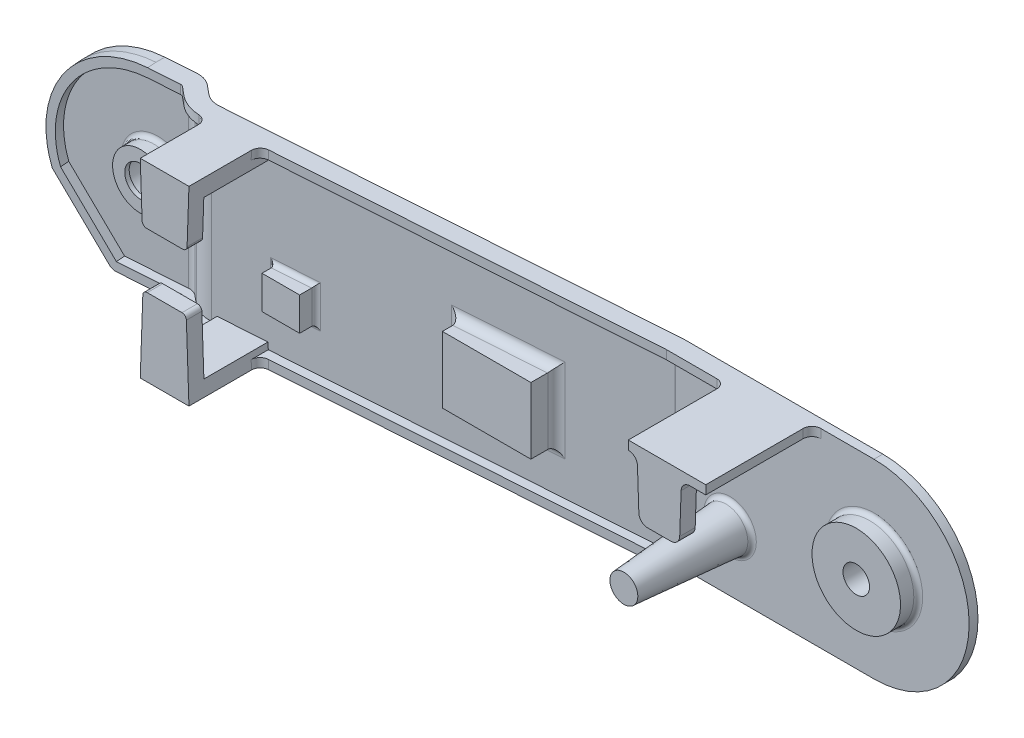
SolidWorks part; units mm, degrees
ref_plane "Plan de face" through (0, 0, 0) normal (0, 0, 1) x (1, 0, 0)
ref_plane "Plan de dessus" through (0, 0, 0) normal (0, 1, 0) x (1, 0, 0)
ref_plane "Plan de droite" through (0, 0, 0) normal (1, 0, 0) x (0, 0, -1)
inserted part "avt bras droit01<1>Assemblage1"
sketch "Esquisse2" plane through (0, 0, 0) normal (0, 0, 1) x (1, 0, 0)
  line L0 (-283.5, 43) -> (-282.6595, 18.9302)
  line L1 (-89.7206, 43) -> (-285.4403, 43) construction
  line L2 (-280.6607, 17) -> (-264.3393, 17)
  line L3 (-262.3405, 18.9302) -> (-261.5, 43)
  line L4 (-261.5, 43) -> (-283.5, 43)
  line L5 (-272.5, 72.3217) -> (-272.5, -3.6699) construction
  line L6 (-261.5, 92.2605) -> (-261.5, -33.5548) construction
  line L7 (-282.5921, 90.6779) -> (-282.5921, -30.1645) construction
  arc A0 (-280.6607, 17) -> (-282.6595, 18.9302) centre (-280.6607, 19) cw
  arc A1 (-262.3405, 18.9302) -> (-264.3393, 17) centre (-264.3393, 19) cw
  point P15 (-282.5921, 17)
  dimension "D6" = 2
  dimension "D7" = 2
  dimension "D1" = 22
  dimension "D2" = 11
  dimension "D3" = 272.5
  dimension "D4" = 2
  dimension "D5" = 2
  dimension "D8" = 26
extrude "Extrusion1" add sketch "Esquisse2" along normal blind 56
sketch "Esquisse3" plane through (0, 43, 0) normal (0, 1, 0) x (-1, 0, 0)
  line L0 (261.5, 11.9924) -> (283.5, 13.5308)
  line L1 (283.5, 13.5308) -> (283.5, 0)
  line L2 (283.5, 0) -> (261.5, 0)
  line L3 (261.5, 0) -> (261.5, 11.9924)
extrude "Enlèv. mat.-Extru.1" cut sketch "Esquisse3" against normal through all
sketch "Esquisse6" plane through (0, 17, 0) normal (0, -1, 0) x (1, 0, 0)
  line L0 (-264.7148, 16.227) -> (-258.0219, 15.759) construction
  line L1 (-280.6607, 17.3421) -> (-264.3393, 16.2008) construction
  line L2 (-258.0219, 15.759) -> (-285.1238, 17.6541) construction
  line L3 (-283.5387, 17.5433) -> (-260.9848, 15.9662)
  line L4 (-260.9848, 15.9662) -> (-260.9848, 45)
  line L5 (-260.9848, 45) -> (-283.5387, 45)
  line L6 (-283.5387, 45) -> (-283.5387, 17.5433)
  line L7 (-280.6607, 56) -> (-264.3393, 56) construction
  dimension "D1" = 11
extrude "Enlèv. mat.-Extru.3" cut sketch "Esquisse6" against normal blind 18
sketch "Esquisse8" plane through (0, 0, 56) normal (0, 0, 1) x (1, 0, 0)
  line L0 (-283.5, -43) -> (-261.5, -43)
  line L1 (-285.4403, -43) -> (-87.4759, -43) construction
  line L2 (-261.5, -43) -> (-262.6548, -9.9302)
  line L3 (-264.6536, -8) -> (-280.3464, -8)
  line L4 (-282.3452, -9.9302) -> (-283.5, -43)
  line L5 (-272.5, 56.3461) -> (-272.5, -71.7255) construction
  line L6 (-283.5, -2.5567) -> (-283.5, -61.1241) construction
  line L7 (-261.5, 6.465) -> (-261.5, -60.2367) construction
  arc A0 (-282.3452, -9.9302) -> (-280.3464, -8) centre (-280.3464, -10) cw
  arc A1 (-262.6548, -9.9302) -> (-264.6536, -8) centre (-264.6536, -10) ccw
  dimension "D4" = 2
  dimension "D1" = 22
  dimension "D2" = 11
  dimension "D3" = 272.5
  dimension "D5" = 2
  dimension "D6" = 2
  dimension "D7" = 35
extrude "Extrusion2" add sketch "Esquisse8" against normal up to next
sketch "Esquisse9" plane through (0, -8, 0) normal (0, 1, 0) x (-1, 0, 0)
  line L0 (279.6459, 17.2711) -> (289.4305, 17.9553) construction
  line L2 (264.6536, 16.2227) -> (280.3464, 17.3201) construction
  line L3 (289.4305, 17.9553) -> (260.9602, 15.9645) construction
  line L4 (260.9602, 15.9645) -> (284.5382, 17.6132)
  line L5 (284.5382, 17.6132) -> (284.5382, 45)
  line L6 (284.5382, 45) -> (260.9602, 45)
  line L7 (260.9602, 45) -> (260.9602, 15.9645)
  line L8 (264.6536, 56) -> (280.3464, 56) construction
  dimension "D1" = 11
extrude "Enlèv. mat.-Extru.4" cut sketch "Esquisse9" against normal blind 28
sketch "Esquisse10" plane through (0, 0, 4) normal (0, 0, 1) x (1, 0, 0)
  line L0 (-250, 20.9787) -> (-250, -99.7083) construction
  line L1 (-258.5, -4.5) -> (-241.5, -4.5)
  line L2 (-258.5, -4.5) -> (-258.5, -19.5)
  line L3 (-258.5, -19.5) -> (-241.5, -19.5)
  line L4 (-241.5, -4.5) -> (-241.5, -19.5)
  line L5 (-276.2948, -12) -> (-204.1654, -12) construction
  dimension "D1" = 17
  dimension "D2" = 15
  dimension "D3" = 8.5
  dimension "D4" = 7.5
  dimension "D5" = 12
  dimension "D6" = 250
extrude "Extrusion3" add sketch "Esquisse10" along normal blind 18
sketch "Esquisse11" plane through (0, -4.5, 0) normal (0, 1, 0) x (-1, 0, 0)
  line L0 (241.5, 10.5939) -> (241.5, 4)
  line L1 (241.5, 4) -> (258.5, 4)
  line L2 (258.5, 4) -> (258.5, 11.7827)
  line L3 (258.5, 11.7827) -> (241.5, 10.5939)
extrude "Enlèv. mat.-Extru.5" cut sketch "Esquisse11" against normal through all
fillet "Congé1" radius 2 4 edges at (-258.5, -12, 15.7924) (-250, -19.5, 15.1981) (-250, -4.5, 15.1981) (-241.5, -12, 14.6037)
fillet "Congé2" radius 4 5 edges at (-285.4403, 41, 21.6861) (-63, 41, 8) (-28, 41, 4) (-283.4302, 41, 21.5455) (-261.5698, 41, 20.0169)
fillet "Congé3" radius 4 3 edges at (-285.4403, -41, 21.6861) (-261.5698, -41, 20.0169) (-283.4302, -41, 21.5455)
ref_plane "Plan1" through (0, 0, 6) normal (0, 0, -1) x (-1, 0, 0)
sketch "Esquisse12" plane through (0, 0, 6) normal (0, 0, -1) x (-1, 0, 0)
  line L0 (393.3523, 0) -> (-164.8619, 0) construction
  line L2 (300, 10) -> (150, 10)
  line L3 (300, 10) -> (300, -10)
  line L4 (300, -10) -> (150, -10)
  line L5 (150, 10) -> (150, -10)
  dimension "D1" = 150
  dimension "D2" = 10
  dimension "D3" = 20
  dimension "D4" = 300
extrude "Extrusion4" add sketch "Esquisse12" against normal up to body separate body
sketch "Esquisse13" plane through (0, 0, 12) normal (0, 0, 1) x (1, 0, 0)
  circle A0 centre (0, 0) radius 6
extrude "Enlèv. mat.-Extru.6" cut sketch "Esquisse13" against normal through all
sketch "Esquisse14" plane through (0, 0, 0) normal (0, 0, -1) x (-1, 0, 0)
  circle A0 centre (0, 0) radius 7.5
extrude "Enlèv. mat.-Extru.7" cut sketch "Esquisse14" against normal blind 1
sketch "Esquisse16" plane through (0, 0, 0) normal (0, 0, -1) x (-1, 0, 0)
  circle A0 centre (317.5, 0) radius 12.5
  dimension "D1" = 25
extrude "Extrusion5" add sketch "Esquisse16" against normal blind 18
sketch "Esquisse17" plane through (0, 43, 0) normal (0, 1, 0) x (-1, 0, 0)
  line L0 (295, 5) -> (340, 5) construction
  line L1 (303.1093, 5) -> (333.3189, 5)
  line L2 (303.1093, 5) -> (303.1093, -2.7136)
  line L3 (303.1093, -2.7136) -> (333.3189, -2.7136)
  line L4 (333.3189, 5) -> (333.3189, -2.7136)
extrude "Enlèv. mat.-Extru.9" cut sketch "Esquisse17" against normal blind 110
fillet "Congé4" radius 2 1 edges at (-305, 0, 10.038)
sketch "Esquisse19" plane through (0, 0, 5) normal (0, 0, -1) x (-1, 0, 0)
  circle A0 centre (317.5, 0) radius 9
extrude "Enlèv. mat.-Extru.10" cut sketch "Esquisse19" against normal blind 11
sketch "Esquisse20" plane through (0, 0, 18) normal (0, 0, 1) x (1, 0, 0)
  circle A0 centre (-317.5, 0) radius 7
  dimension "D1" = 14
  dimension "D2" = 317.5
extrude "Enlèv. mat.-Extru.11" cut sketch "Esquisse20" against normal blind 11
sketch "Esquisse21" plane through (0, 0, 56) normal (0, 0, 1) x (1, 0, 0)
  line L0 (-262.3405, 18.9302) -> (-261.5, 43) construction
  line L1 (-280.6607, 17) -> (-264.3393, 17) construction
  line L2 (-283.5, 43) -> (-282.6595, 18.9302) construction
  line L3 (-261.5, 43) -> (-283.5, 43) construction
  line L4 (-262.3405, 18.9302) -> (-261.5, 43)
  line L5 (-280.6607, 17) -> (-264.3393, 17)
  line L6 (-283.5, 43) -> (-282.6595, 18.9302)
  line L7 (-261.5, 43) -> (-283.5, 43)
  arc A0 (-282.6595, 18.9302) -> (-280.6607, 17) centre (-280.6607, 19) ccw construction
  arc A1 (-264.3393, 17) -> (-262.3405, 18.9302) centre (-264.3393, 19) ccw construction
  arc A2 (-282.6595, 18.9302) -> (-280.6607, 17) centre (-280.6607, 19) ccw
  arc A3 (-264.3393, 17) -> (-262.3405, 18.9302) centre (-264.3393, 19) ccw
extrude "Enlèv. mat.-Extru.12" cut sketch "Esquisse21" against normal blind 4
sketch "Esquisse22" plane through (0, 0, 56) normal (0, 0, 1) x (1, 0, 0)
  line L0 (-282.3452, -9.9302) -> (-283.5, -43) construction
  line L1 (-261.5, -43) -> (-262.6548, -9.9302) construction
  line L2 (-283.5, -43) -> (-261.5, -43) construction
  line L3 (-264.6536, -8) -> (-280.3464, -8) construction
  line L4 (-282.3452, -9.9302) -> (-283.5, -43)
  line L5 (-261.5, -43) -> (-262.6548, -9.9302)
  line L6 (-283.5, -43) -> (-261.5, -43)
  line L7 (-264.6536, -8) -> (-280.3464, -8)
  arc A0 (-262.6548, -9.9302) -> (-264.6536, -8) centre (-264.6536, -10) ccw construction
  arc A1 (-280.3464, -8) -> (-282.3452, -9.9302) centre (-280.3464, -10) ccw construction
  arc A2 (-262.6548, -9.9302) -> (-264.6536, -8) centre (-264.6536, -10) ccw
  arc A3 (-280.3464, -8) -> (-282.3452, -9.9302) centre (-280.3464, -10) ccw
extrude "Enlèv. mat.-Extru.13" cut sketch "Esquisse22" against normal blind 4
sketch "Esquisse24" plane through (0, 0, 56) normal (0, 0, 1) x (1, 0, 0)
  line L1 (-77.2613, -7.344) -> (-55.4178, -7.344)
  line L2 (-77.2613, -7.344) -> (-77.2613, -23.5965)
  line L3 (-77.2613, -23.5965) -> (-55.4178, -23.5965)
  line L4 (-55.4178, -7.344) -> (-55.4178, -23.5965)
extrude "Enlèv. mat.-Extru.15" cut sketch "Esquisse24" against normal blind 4
sketch "Esquisse25" plane through (0, 0, 56) normal (0, 0, 1) x (1, 0, 0)
  line L1 (-70.0188, 45.0575) -> (-18.9725, 45.0575)
  line L2 (-70.0188, 45.0575) -> (-70.0188, 6.2078)
  line L3 (-70.0188, 6.2078) -> (-18.9725, 6.2078)
  line L4 (-18.9725, 45.0575) -> (-18.9725, 6.2078)
extrude "Enlèv. mat.-Extru.16" cut sketch "Esquisse25" against normal blind 4
sketch "Esquisse26" plane through (0, 0, 49) normal (0, 0, -1) x (-1, 0, 0)
  line L0 (58.2269, 16.8604) -> (58.7929, 33.0686) construction
  line L1 (43.7707, 13) -> (54.2293, 13) construction
  line L2 (39.231, 32.3855) -> (39.7731, 16.8604) construction
  line L3 (39.231, 32.3855) -> (39.7731, 16.8604)
  line L4 (43.7707, 13) -> (54.2293, 13)
  line L5 (58.2269, 16.8604) -> (58.7929, 33.0686)
  line L6 (58.7929, 33.0686) -> (39.231, 32.3855)
  arc A0 (54.2293, 13) -> (58.2269, 16.8604) centre (54.2293, 17) ccw construction
  arc A1 (39.7731, 16.8604) -> (43.7707, 13) centre (43.7707, 17) ccw construction
  arc A2 (39.7731, 16.8604) -> (43.7707, 13) centre (43.7707, 17) ccw
  arc A3 (54.2293, 13) -> (58.2269, 16.8604) centre (54.2293, 17) ccw
extrude "Extrusion6" add sketch "Esquisse26" along normal blind 4
sketch "Esquisse27" plane through (0, 0, 52) normal (0, 0, 1) x (1, 0, 0)
  point P0 (-172, 0)
  dimension "D1" = 172
